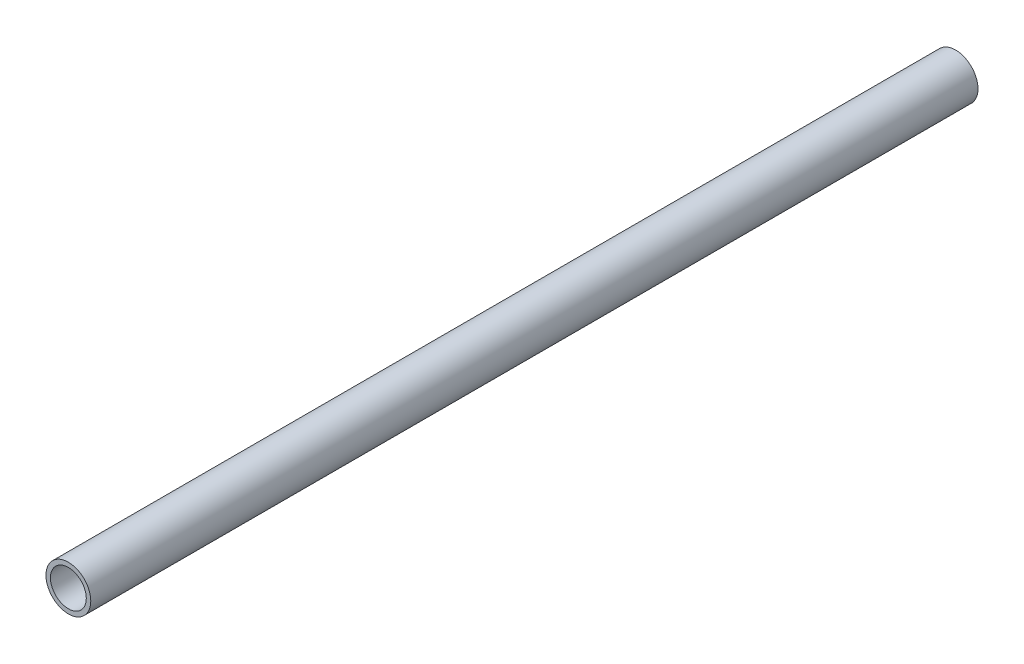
SolidWorks part; units mm, degrees
ref_plane "Front" through (0, 0, 0) normal (0, 0, 1) x (1, 0, 0)
ref_plane "Top" through (0, 0, 0) normal (0, 1, 0) x (1, 0, 0)
ref_plane "Right" through (0, 0, 0) normal (1, 0, 0) x (0, 0, -1)
sketch "Sketch1" plane through (0, 0, 0) normal (0, 0, 1) x (1, 0, 0)
  circle A0 centre (0, 0) radius 15.875
  circle A1 centre (0, 0) radius 12.7
  dimension "D1" = 31.75
  dimension "D2" = 25.4
extrude "Boss-Extrude1" add sketch "Sketch1" along normal mid plane 628.65
ref_plane "Plane1" through (0, 0, 276.225) normal (0, 0, 1) x (1, 0, 0)
